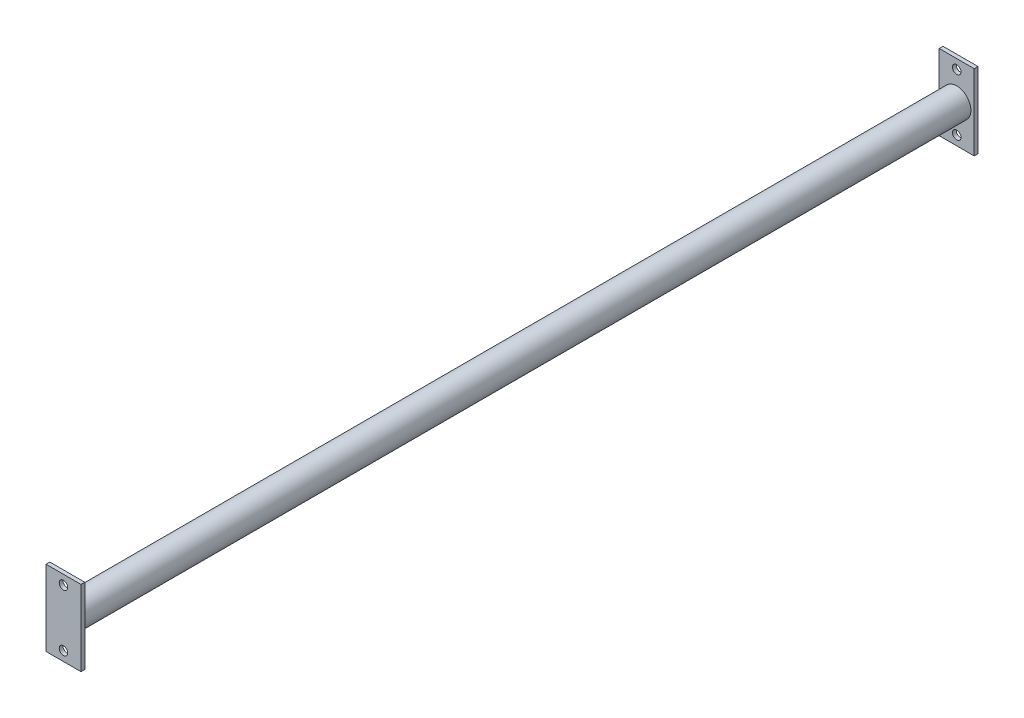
SolidWorks part; units mm, degrees
ref_plane "Plan de face" through (0, 0, 0) normal (0, 0, 1) x (1, 0, 0)
ref_plane "Plan de dessus" through (0, 0, 0) normal (0, 1, 0) x (1, 0, 0)
ref_plane "Plan de droite" through (0, 0, 0) normal (1, 0, 0) x (0, 0, -1)
sketch "Esquisse1" plane through (0, 0, 0) normal (0, 0, 1) x (1, 0, 0)
  circle A0 centre (0, 0) radius 15
  circle A1 centre (0, 0) radius 14
  dimension "D1" = 28
  dimension "D2" = 30
extrude "Extrusion1" add sketch "Esquisse1" along normal blind 470.5
sketch "Esquisse2" plane through (0, 0, 470.5) normal (0, 0, 1) x (1, 0, 0)
  line L1 (-18.5, 40) -> (18.5, 40)
  line L2 (-18.5, 40) -> (-18.5, -40)
  line L3 (-18.5, -40) -> (18.5, -40)
  line L4 (18.5, 40) -> (18.5, -40)
  circle A0 centre (0, -30) radius 4.5
  circle A1 centre (0, 30) radius 4.5
  dimension "D5" = 9
  dimension "D6" = 9
  dimension "D1" = 18.5
  dimension "D2" = 37
  dimension "D3" = 80
  dimension "D4" = 40
  dimension "D7" = 30
  dimension "D8" = 30
extrude "Extrusion2" add sketch "Esquisse2" along normal blind 4
mirror "Symétrie3" about plane through (0, 0, 0) normal (0, 0, 1) of "Extrusion2", "Extrusion1"
